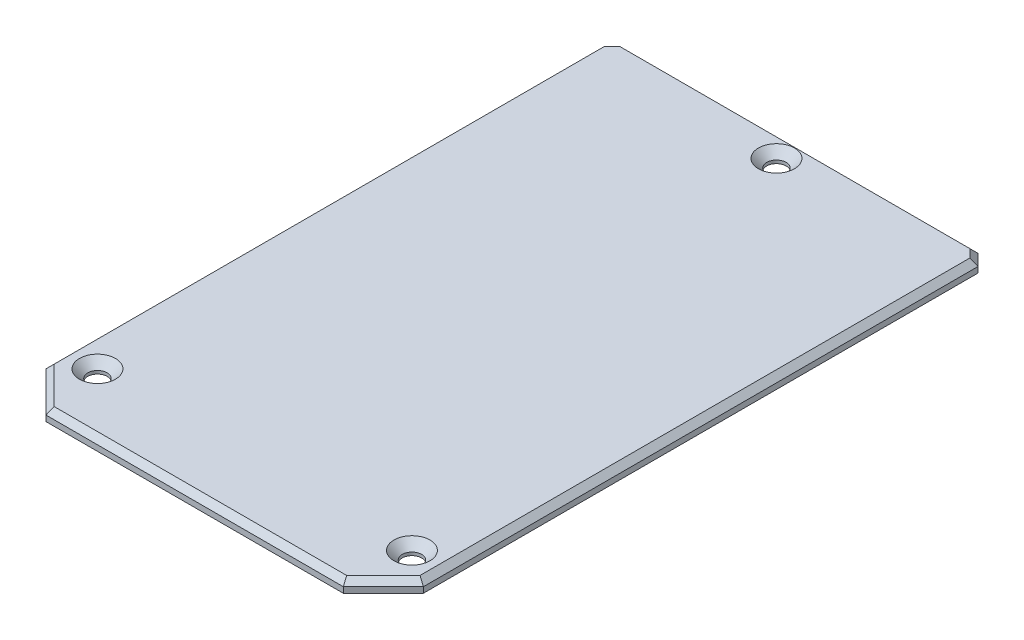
SolidWorks part; units mm, degrees
ref_plane "Front Plane" through (0, 0, 0) normal (0, 0, 1) x (1, 0, 0)
ref_plane "Top Plane" through (0, 0, 0) normal (0, 1, 0) x (1, 0, 0)
ref_plane "Right Plane" through (0, 0, 0) normal (1, 0, 0) x (0, 0, -1)
sketch "Sketch1" plane through (0, 0, 0) normal (0, 1, 0) x (1, 0, 0)
  line L0 (-33, -46) -> (-26, -53)
  line L1 (-33, -46) -> (-33, 53)
  line L2 (-33, 53) -> (33, 53)
  line L3 (33, -46) -> (33, 53)
  line L4 (-33, -46) -> (33, 53) construction
  line L5 (-33, 53) -> (33, -46) construction
  line L6 (33, -46) -> (26, -53)
  line L7 (26, -53) -> (-26, -53)
  point P0 (0, 3.5)
  dimension "D1" = 26
  dimension "D2" = 33
  dimension "D3" = 3.5
  dimension "D4" = 53
extrude "Boss-Extrude1" add sketch "Sketch1" along normal blind 2
chamfer "Chamfer1" distance 2 angle 45 2 edges at (33, 1, -53) (-33, 1, -53)
hole_wizard "CSK for M3 Flat Head Machine Screw1" positions "Sketch3" profile "Sketch4" countersink size "M3" standard "ANSI Metric"
sketch "Sketch3" plane through (0, 2, 0) normal (0, 1, 0) x (1, 0, 0)
  line L0 (-33, 51) -> (-33, -46) construction
  line L1 (31, 53) -> (-31, 53) construction
  point P0 (0, 48.75)
  dimension "D1" = 33
  dimension "D2" = 4.25
sketch "Sketch4" plane through (0, 2, -48.75) normal (1, 0, 0) x (0, 0, 1)
  line L0 (0, 0) -> (0, 2)
  line L1 (0, 2) -> (1.7, 2)
  line L2 (1.7, 2) -> (1.7, 1.45)
  line L3 (1.7, 1.45) -> (3.15, 0)
  line L5 (3.15, 0) -> (0, 0)
  line L6 (-1.7, 1.45) -> (-3.15, 0) construction
  line L11 (0, -6.35) -> (0, 107.95) construction
  dimension "Thru Hole Dia." = 3.4
  dimension "Thru Hole Depth" = 2
  dimension "Near C'Sink Dia." = 6.3
  dimension "Near C'Sink Angle" = 90
hole_wizard "CSK for M3 Flat Head Machine Screw2" positions "Sketch5" profile "Sketch6" countersink size "M3" standard "ANSI Metric"
sketch "Sketch5" plane through (0, 2, 0) normal (0, 1, 0) x (1, 0, 0)
  line L0 (-33, 51) -> (-33, -46) construction
  line L1 (31, 53) -> (-31, 53) construction
  line L2 (33, -46) -> (33, 51) construction
  point P0 (-27.5, -42.5)
  point P2 (27.5, -42.5)
  dimension "D1" = 5.5
  dimension "D2" = 95.5
  dimension "D3" = 5.5
  dimension "D4" = 95.5
sketch "Sketch6" plane through (-27.5, 2, 42.5) normal (1, 0, 0) x (0, 0, 1)
  line L0 (0, 0) -> (0, 2)
  line L1 (0, 2) -> (1.7, 2)
  line L2 (1.7, 2) -> (1.7, 1.45)
  line L3 (1.7, 1.45) -> (3.15, 0)
  line L5 (3.15, 0) -> (0, 0)
  line L6 (-1.7, 1.45) -> (-3.15, 0) construction
  line L11 (0, -6.35) -> (0, 107.95) construction
  dimension "Thru Hole Dia." = 3.4
  dimension "Thru Hole Depth" = 2
  dimension "Near C'Sink Dia." = 6.3
  dimension "Near C'Sink Angle" = 90
chamfer "Chamfer2" distance 1 angle 45 8 edges at (-29.5, 2, 49.5) (0, 2, 53) (29.5, 2, 49.5) (33, 2, -2.5) (32, 2, -52) (0, 2, -53) (-32, 2, -52) (-33, 2, -2.5)
